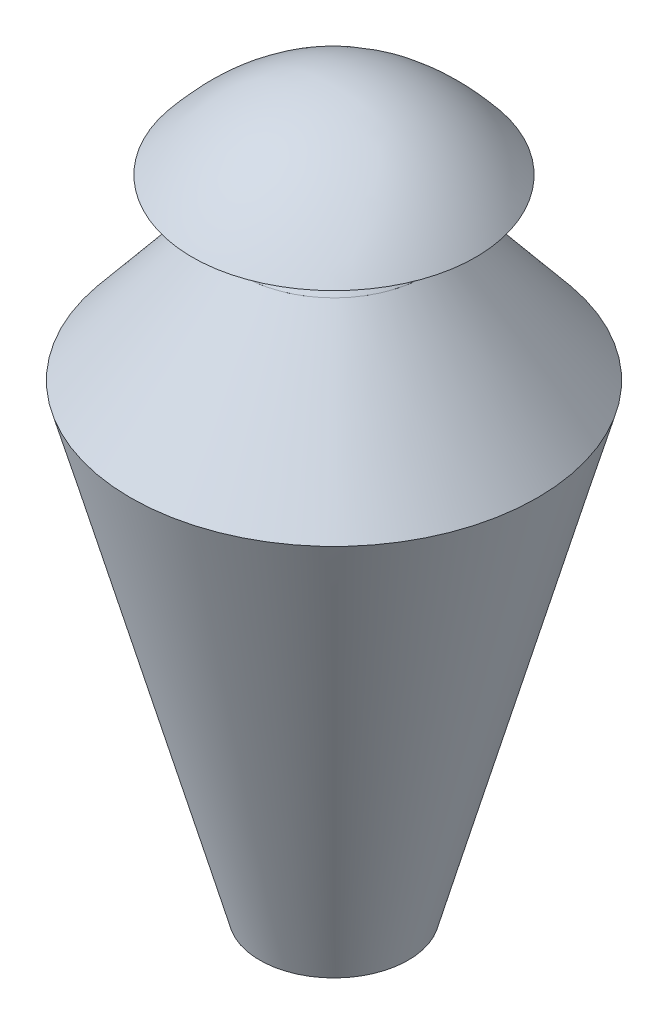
SolidWorks part; units mm, degrees
ref_plane "Front" through (0, 0, 0) normal (0, 0, 1) x (1, 0, 0)
ref_plane "Top" through (0, 0, 0) normal (0, 1, 0) x (1, 0, 0)
ref_plane "Right" through (0, 0, 0) normal (1, 0, 0) x (0, 0, -1)
sketch "Sketch1" plane through (0, 0, 0) normal (0, 0, 1) x (1, 0, 0)
  line L0 (0, 0) -> (0, 100) construction
  line L1 (11.3512, 0) -> (31.088, 71.0778)
  line L2 (31.088, 71.0778) -> (13.9563, 91.8668)
  line L3 (13.9563, 91.8668) -> (6.6179, 0)
  line L4 (6.6179, 0) -> (11.3512, 0)
  dimension "D1" = 100
revolve "Revolve1" add sketch "Sketch1" angle 360 about L0
surface "Surface-Fill3"
surface "Surface-Offset2" parameters "D1"=10
